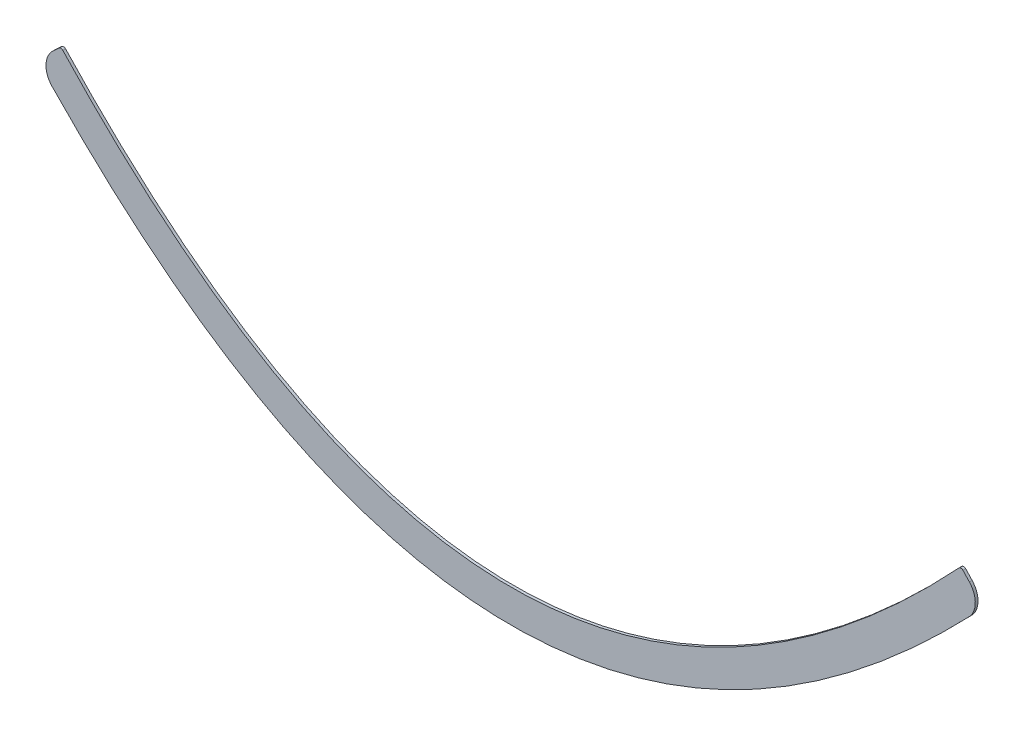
SolidWorks part; units mm, degrees
ref_plane "Front Plane" through (0, 0, 0) normal (0, 0, 1) x (1, 0, 0)
ref_plane "Top Plane" through (0, 0, 0) normal (0, 1, 0) x (1, 0, 0)
ref_plane "Right Plane" through (0, 0, 0) normal (1, 0, 0) x (0, 0, -1)
sketch "Sketch1" plane through (0, 0, 0) normal (0, 0, 1) x (1, 0, 0)
  line L0 (0, 0) -> (1092.2, 0) construction
  line L1 (1092.2, 0) -> (1092.2, -101.6) construction
  line L2 (1092.2, -101.6) -> (1092.2, -584.2) construction
  line L3 (50.8, -22.3921) -> (1092.2, -22.3921) construction
  line L4 (1092.2, -22.3921) -> (2133.6, -22.3921) construction
  line L5 (2185.544, -78.437) -> (2199.7426, -67.1313) construction
  line L6 (50.8, -22.3921) -> (-5.0874, -74.1902)
  line L7 (2133.6, -22.3921) -> (2152.2768, -7.5205) construction
  line L8 (2133.6, -22.3921) -> (2185.544, -78.437)
  line L9 (0, 0) -> (0, -254) construction
  parabola Q0
  spline S0 degree 1 poles (-5.0874, -74.1902) (2185.544, -78.437) knots 0 0 1 1 construction
  spline S1 degree 3 poles (-5.0874, -74.1902) (-2.3187, -77.1775) (3.2382, -83.1497) (14.3358, -94.9834) (28.2211, -109.6144) (44.8912, -126.8994) (67.1337, -149.5879) (94.9645, -177.2746) (128.4089, -209.4203) (161.903, -240.4865) (206.6312, -280.4672) (262.6779, -327.7381) (330.1717, -380.1211) (397.9222, -428.1434) (465.9466, -471.7813) (557.0283, -524.0802) (671.6229, -578.3353) (810.3004, -625.3202) (949.9356, -653.8213) (1090.1229, -663.5465) (1230.3187, -654.3801) (1369.977, -626.4315) (1508.6868, -579.9888) (1623.311, -526.1766) (1714.4158, -474.2276) (1782.4569, -430.8502) (1850.2232, -383.0869) (1917.7316, -330.9616) (1973.7896, -283.9047) (2018.5262, -244.0947) (2052.0264, -213.1565) (2085.4765, -181.1385) (2113.3119, -153.5583) (2135.5579, -130.9548) (2152.2306, -113.7337) (2166.118, -99.1558) (2177.2173, -87.3646) (2182.7749, -81.4137) (2185.544, -78.437) knots 0.488149 0.488149 0.488149 0.488149 0.488241 0.488334 0.488518 0.488703 0.488888 0.489258 0.489627 0.489997 0.490367 0.491106 0.491845 0.492585 0.493324 0.494063 0.495542 0.497021 0.498499 0.499978 0.501457 0.502935 0.504414 0.505893 0.506632 0.507371 0.508111 0.50885 0.509589 0.509959 0.510329 0.510698 0.511068 0.511253 0.511438 0.511623 0.511715 0.511807 0.511807 0.511807 0.511807
  dimension "D1" = 1092.2
  dimension "D2" = 101.6
  dimension "D3" = 482.6
  dimension "D4" = 1041.4
  dimension "D6" = 254
  dimension "D5" = 76.2
extrude "Boss-Extrude1" add sketch "Sketch1" along normal blind 6.35
fillet "Fillet1" radius 6.35 2 edges at (2133.6, -22.3921, 3.175) (50.8, -22.3921, 3.175)
fillet "Fillet2" radius 50.8 2 edges at (2185.544, -78.437, 3.175) (-5.0874, -74.1902, 3.175)
sketch "Sketch2" plane through (0, 0, 0) normal (0, 0, 1) x (1, 0, 0)
  line L0 (2121.9049, -101.6) -> (62.4951, -101.6)
